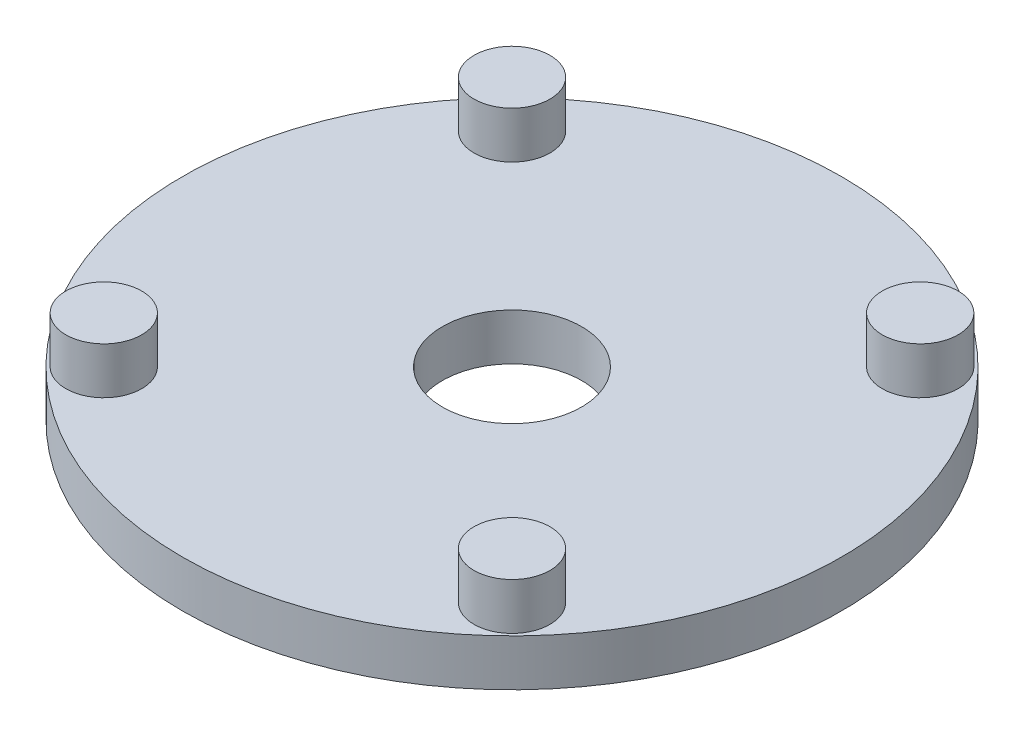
SolidWorks part; units mm, degrees
ref_plane "Front Plane" through (0, 0, 0) normal (0, 0, 1) x (1, 0, 0)
ref_plane "Top Plane" through (0, 0, 0) normal (0, 1, 0) x (1, 0, 0)
ref_plane "Right Plane" through (0, 0, 0) normal (1, 0, 0) x (0, 0, -1)
sketch "Sketch1" plane through (0, 0, 0) normal (0, 1, 0) x (1, 0, 0)
  circle A0 centre (0, 0) radius 29
  circle A1 centre (0, 0) radius 6.13
  dimension "D1" = 58
  dimension "D2" = 12.26
extrude "Boss-Extrude1" add sketch "Sketch1" along normal mid plane 4.11 contours A0 | A1
sketch "Sketch2" plane through (0, 2.055, 0) normal (0, 1, 0) x (1, 0, 0)
  line L0 (0, 0) -> (-17.9605, 17.9605) construction
  line L1 (0, 0) -> (-29, 0) construction
  line L2 (0, 0) -> (-17.9605, 17.9605) construction
  line L3 (0, 0) -> (-17.9605, -17.9605) construction
  circle A0 centre (-17.9605, 17.9605) radius 3.34
  circle A1 centre (0, 0) radius 29 construction
  circle A2 centre (-17.9605, -17.9605) radius 3.34
  circle A3 centre (17.9605, -17.9605) radius 3.34
  circle A4 centre (17.9605, 17.9605) radius 3.34
  point P2 (0, 0)
  point P3 (0, 0)
  point P10 (0, 0)
  point P18 (0, 0)
  point P19 (0, 0)
  point P20 (0, 0)
  point P21 (0, 0)
  dimension "D2" = 6.68
  dimension "D1" = 45
  dimension "D3" = 25.4
  dimension "D5" = 90
  dimension "D4" = 4
extrude "Boss-Extrude2" add sketch "Sketch2" along normal blind 4.11
